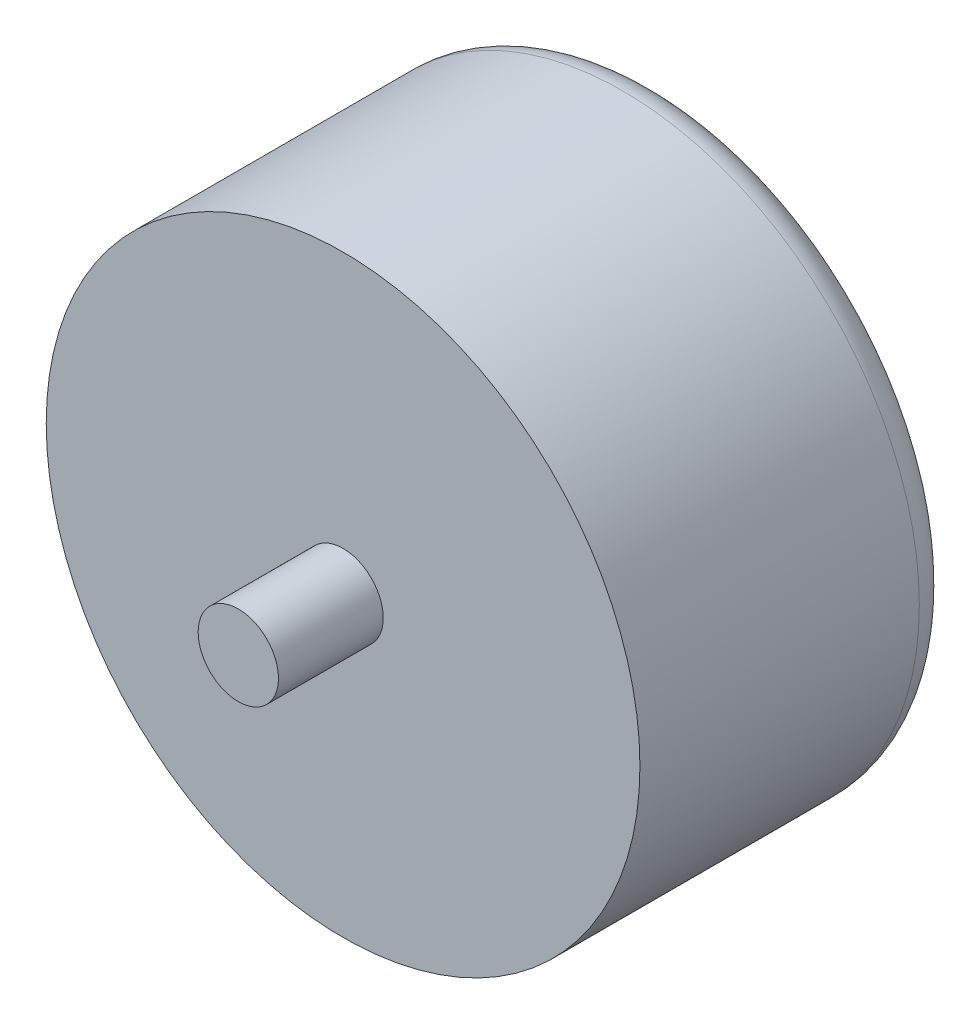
SolidWorks part; units mm, degrees
ref_plane "Front Plane" through (0, 0, 0) normal (0, 0, 1) x (1, 0, 0)
ref_plane "Top Plane" through (0, 0, 0) normal (0, 1, 0) x (1, 0, 0)
ref_plane "Right Plane" through (0, 0, 0) normal (1, 0, 0) x (0, 0, -1)
body saved out of another part "Stock-Donut Shop-1"
ref_plane "Plane1" through (186, 0, 0) normal (1, 0, 0) x (0, 0, -1)
